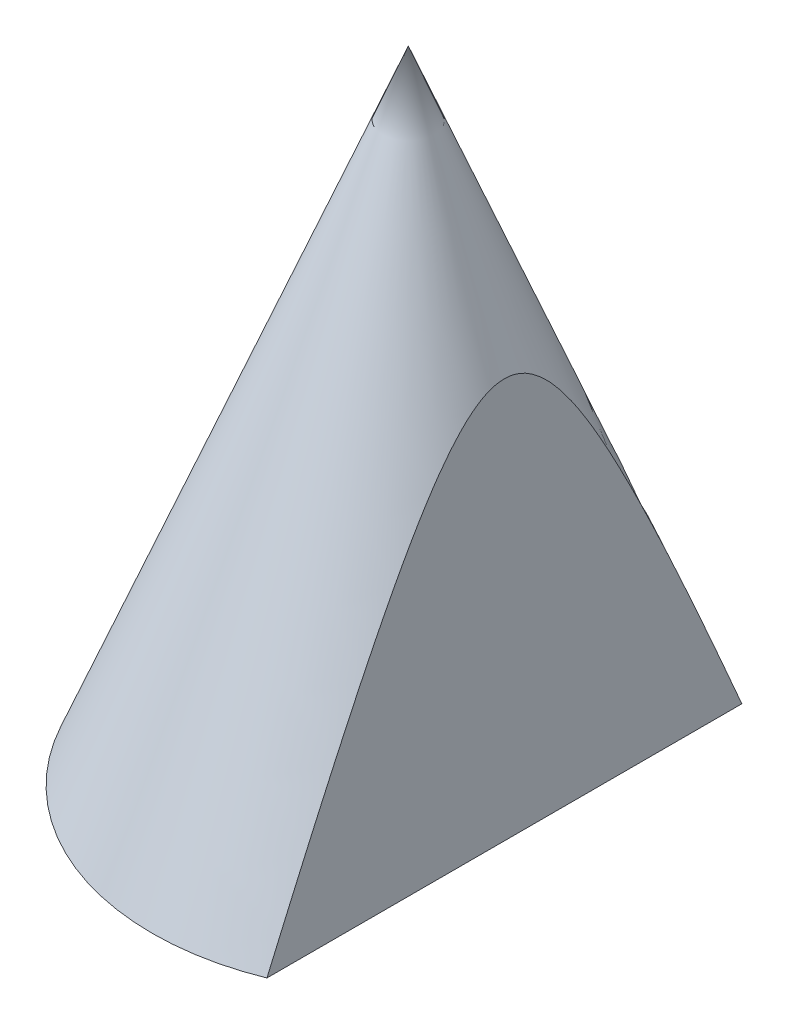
SolidWorks part; units mm, degrees
ref_plane "前视" through (0, 0, 0) normal (0, 0, 1) x (1, 0, 0)
ref_plane "上视" through (0, 0, 0) normal (0, 1, 0) x (1, 0, 0)
ref_plane "右视" through (0, 0, 0) normal (1, 0, 0) x (0, 0, -1)
sketch "草图1" plane through (0, 0, 0) normal (0, 0, 1) x (1, 0, 0)
  line L0 (0, 0) -> (-16, 0)
  line L1 (-16, 0) -> (0, 40)
  line L2 (0, 40) -> (0, 0)
  line L3 (0, 0) -> (0, -29.9501) construction
  dimension "D1" = 32
  dimension "D2" = 40
revolve "旋转1" add sketch "草图1" angle 360 about L3
sketch "草图3" plane through (0, 0, 0) normal (0, 0, 1) x (1, 0, 0)
  line L0 (6, 48.2186) -> (6, -7.6057)
  dimension "D1" = 6
extrude "切除-拉伸1" cut sketch "草图3" against normal through all and the other way through all
